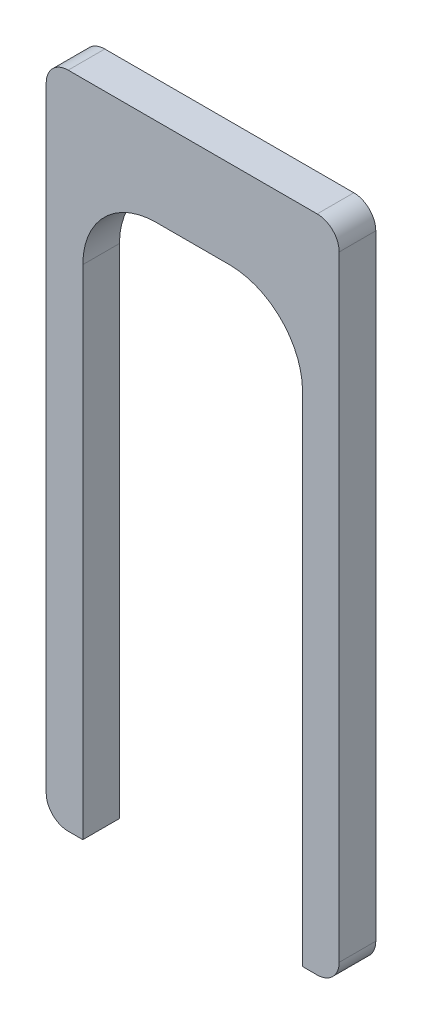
SolidWorks part; units mm, degrees
ref_plane "Front Plane" through (0, 0, 0) normal (0, 0, 1) x (1, 0, 0)
ref_plane "Top Plane" through (0, 0, 0) normal (0, 1, 0) x (1, 0, 0)
ref_plane "Right Plane" through (0, 0, 0) normal (1, 0, 0) x (0, 0, -1)
sketch "Sketch1" plane through (0, 0, 0) normal (0, 0, 1) x (1, 0, 0)
  line L1 (20, -45) -> (-20, -45)
  line L2 (20, -45) -> (20, 45)
  line L3 (20, 45) -> (-20, 45)
  line L4 (-20, -45) -> (-20, 45)
  line L5 (20, -45) -> (-20, 45) construction
  line L6 (20, 45) -> (-20, -45) construction
  point P0 (0, 0)
  dimension "D1" = 90
  dimension "D2" = 40
extrude "Boss-Extrude1" add sketch "Sketch1" along normal mid plane 5
fillet "Fillet1" radius 3 4 edges at (-20, -45, 0) (20, -45, 0) (20, 45, 0) (-20, 45, 0)
sketch "Sketch2" plane through (0, 0, 2.5) normal (0, 0, 1) x (1, 0, 0)
  line L0 (17, 45) -> (-17, 45) construction
  line L1 (15, -45) -> (-15, -45)
  line L2 (15, -45) -> (15, 33)
  line L3 (15, 33) -> (-15, 33)
  line L4 (-15, -45) -> (-15, 33)
  line L5 (15, -45) -> (-15, 33) construction
  line L6 (15, 33) -> (-15, -45) construction
  line L7 (-20, 42) -> (-20, -42) construction
  line L8 (-17, -45) -> (17, -45) construction
  line L9 (0, -6) -> (0, 0) construction
  point P0 (0, -6)
  dimension "D1" = 12
  dimension "D2" = 5
extrude "Cut-Extrude1" cut sketch "Sketch2" against normal through all
fillet "Fillet2" radius 10 2 edges at (15, 33, 0) (-15, 33, 0)
